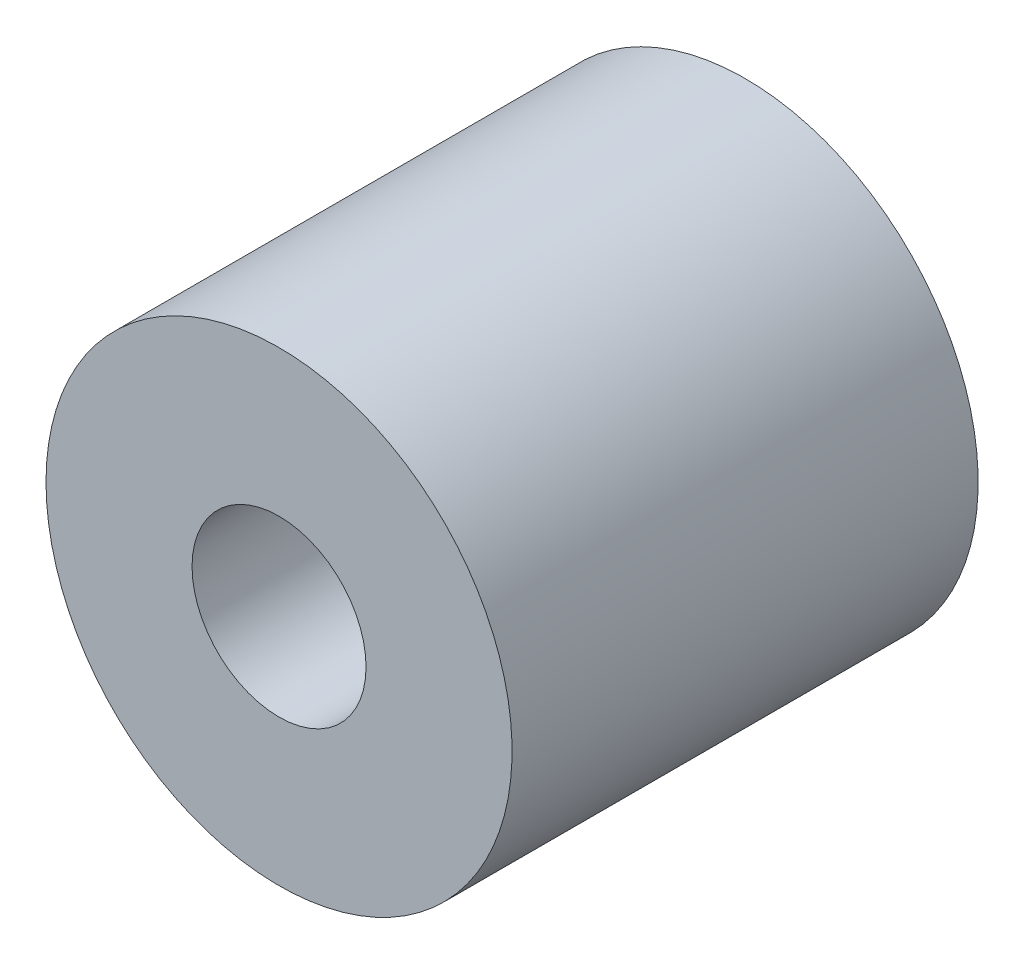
SolidWorks part; units mm, degrees
ref_plane "Front Plane" through (0, 0, 0) normal (0, 0, 1) x (1, 0, 0)
ref_plane "Top Plane" through (0, 0, 0) normal (0, 1, 0) x (1, 0, 0)
ref_plane "Right Plane" through (0, 0, 0) normal (1, 0, 0) x (0, 0, -1)
sketch "Sketch1" plane through (0, 0, 0) normal (0, 0, 1) x (1, 0, 0)
  circle A0 centre (0, 0) radius 4.7625
  circle A1 centre (0, 0) radius 1.778
  dimension "OD" = 9.525
  dimension "ID" = 3.556
extrude "Extrude1" add sketch "Sketch1" along normal mid plane 9.525
sketch "Sketch2" plane through (0, 0, 0) normal (1, 0, 0) x (0, 0, -1)
  line L0 (-4.7625, -1.778) -> (4.7625, -1.778) construction
  line L3 (4.7625, 1.778) -> (-4.7625, 1.778) construction
  line L5 (-4.7625, -1.778) -> (4.7625, -1.778)
  line L6 (4.7625, 1.778) -> (-4.7625, 1.778)
sketch "Sketch4" plane through (0, 0, 4.7625) normal (0, 0, 1) x (1, 0, 0)
  line L0 (0, 0) -> (-1.2572, 1.2572)
  line L1 (0, -4.3656) -> (0, 4.3656) construction
  circle A0 centre (0, 0) radius 1.778 construction
  dimension "D1" = 45
